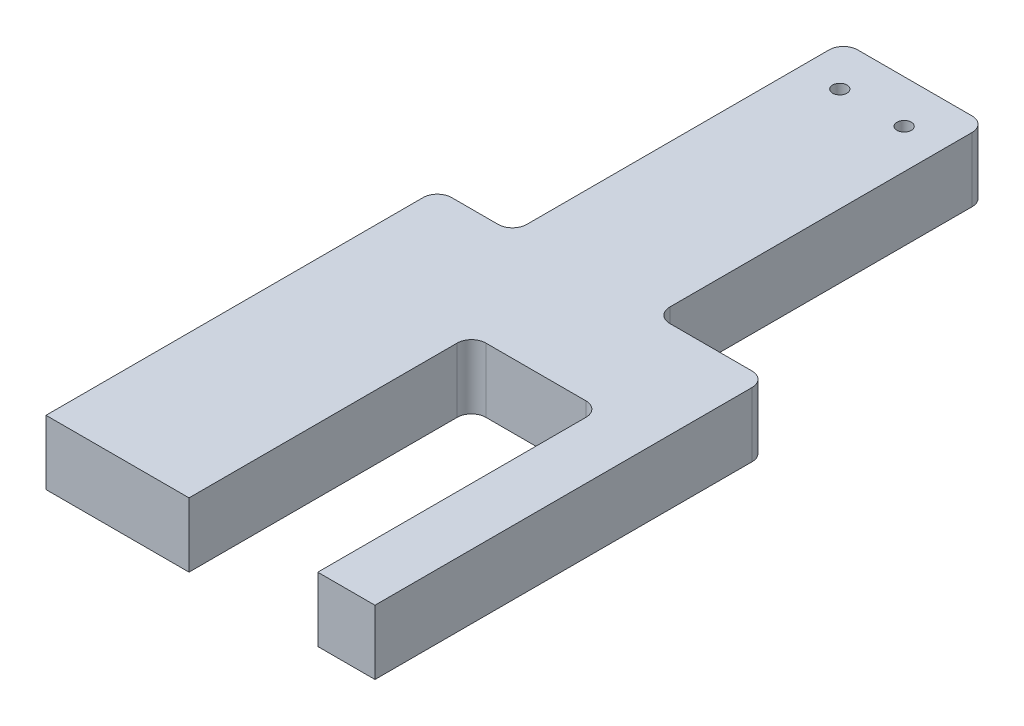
SolidWorks part; units mm, degrees
ref_plane "Front Plane" through (0, 0, 0) normal (0, 0, 1) x (1, 0, 0)
ref_plane "Top Plane" through (0, 0, 0) normal (0, 1, 0) x (1, 0, 0)
ref_plane "Right Plane" through (0, 0, 0) normal (1, 0, 0) x (0, 0, -1)
sketch "Sketch1" plane through (0, 0, 0) normal (0, 1, 0) x (1, 0, 0)
  line L0 (0, 0) -> (0, 51.3145) construction
  line L1 (-22.8872, -39.5) -> (22.8872, -39.5) construction
  line L2 (-13, 55.5) -> (-4, 55.5) construction
  line L3 (-9, 0) -> (9, 0) construction
  line L4 (-9, 0) -> (-9, -39.5)
  line L5 (-9, -39.5) -> (-29, -39.5)
  line L6 (-1.9414, 61.5) -> (11.2869, 61.5) construction
  line L7 (-1.9414, 55.5) -> (40.0184, 55.5) construction
  line L8 (-48.7363, 0) -> (21.3784, 0) construction
  line L9 (-29, -39.5) -> (-29, 15.2276)
  line L10 (-29, 15.2276) -> (-18.5, 15.2276)
  line L11 (-18.5, 15.2276) -> (-18.5, 61.5)
  line L12 (-18.5, 61.5) -> (1.5, 61.5)
  line L13 (9, 0) -> (9, -39.5)
  line L14 (9, -39.5) -> (17, -39.5)
  line L15 (17, -39.5) -> (17, 15.2276)
  line L17 (1.5, 61.5) -> (1.5, 15.2276)
  line L18 (-9, 0) -> (9, 0)
  line L19 (-19, -39.5) -> (-19, -19.5756) construction
  line L20 (1.5, 15.2276) -> (17, 15.2276)
  circle A0 centre (-13, 55.5) radius 1
  circle A1 centre (-4, 55.5) radius 1
  point P0 (0, 0)
  point P20 (0, 0)
  point P21 (-13, 55.5)
  point P33 (0, 61.5)
  dimension "D2" = 4
  dimension "D8" = 8
  dimension "D9" = 2
  dimension "D1" = 95
  dimension "D3" = 9
  dimension "D4" = 18
  dimension "D5" = 39.5
  dimension "D6" = 20
  dimension "D7" = 6
  dimension "D10" = 5.5
  dimension "D11" = 5.5
extrude "Boss-Extrude1" add sketch "Sketch1" along normal blind 9
fillet "Fillet3" radius 2 8 edges at (-29, 4.5, -15.2276) (-18.5, 4.5, -61.5) (1.5, 4.5, -61.5) (-18.5, 4.5, -15.2276) (9, 4.5, 0) (-9, 4.5, 0) (1.5, 4.5, -15.2276) (17, 4.5, -15.2276)
